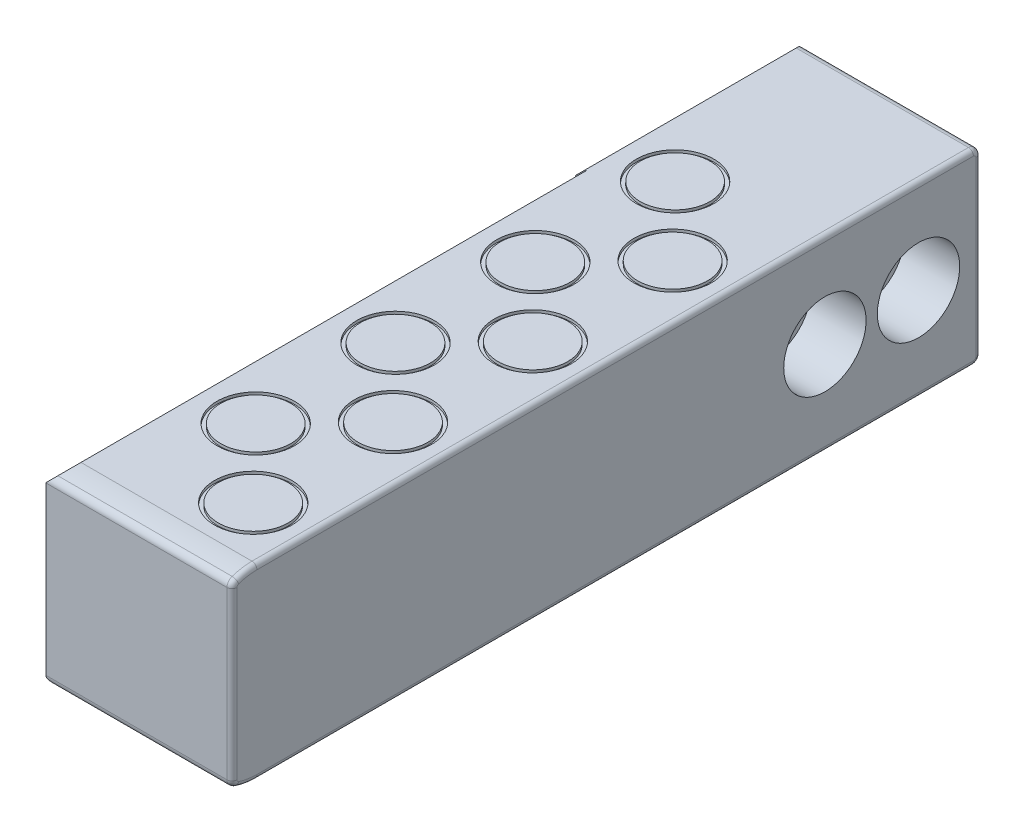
SolidWorks part; units mm, degrees
ref_plane "Front Plane" through (0, 0, 0) normal (0, 0, 1) x (1, 0, 0)
ref_plane "Top Plane" through (0, 0, 0) normal (0, 1, 0) x (1, 0, 0)
ref_plane "Right Plane" through (0, 0, 0) normal (1, 0, 0) x (0, 0, -1)
sketch "Sketch1" plane through (0, 0, 0) normal (1, 0, 0) x (0, 0, -1)
  line L0 (0, 0) -> (-53.975, 0) construction
  line L1 (-51.435, -9.525) -> (21.463, -9.525)
  line L2 (-53.975, -8.4726) -> (-53.975, 8.4726)
  line L3 (-51.435, 9.525) -> (21.463, 9.525)
  line L4 (22.225, -8.763) -> (22.225, 8.763)
  line L5 (0, 0) -> (22.225, 0) construction
  arc A0 (21.463, -9.525) -> (22.225, -8.763) centre (21.463, -8.763) ccw
  arc A1 (21.463, 9.525) -> (22.225, 8.763) centre (21.463, 8.763) cw
  arc A2 (-51.435, 9.525) -> (-53.4555, 9.195) centre (-51.435, 3.175) ccw
  arc A3 (-51.435, -9.525) -> (-53.4555, -9.195) centre (-51.435, -3.175) cw
  arc A4 (-53.975, -8.4726) -> (-53.4555, -9.195) centre (-53.213, -8.4726) ccw
  arc A5 (-53.4555, 9.195) -> (-53.975, 8.4726) centre (-53.213, 8.4726) ccw
  circle A6 centre (15.875, 0) radius 2.794
  circle A7 centre (6.35, 0) radius 2.794
  point P17 (-53.975, -8.9949)
  point P20 (-53.975, 8.9949)
  dimension "D5" = 0.762
  dimension "D9" = 6.35
  dimension "D4" = 0.762
  dimension "D7" = 5.588
  dimension "D10" = 5.588
  dimension "D2" = 76.2
  dimension "D3" = 22.225
  dimension "D6" = 2.54
  dimension "D8" = 6.35
  dimension "D11" = 9.525
  dimension "D12" = 19.05
extrude "Boss-Extrude1" add sketch "Sketch1" against normal blind 19.05
sketch "Sketch2" plane through (0, 9.525, 0) normal (0, 1, 0) x (1, 0, 0)
  line L0 (-19.05, 21.463) -> (-19.05, -51.435) construction
  line L1 (0, 21.463) -> (0, -51.435) construction
  line L5 (-19.05, -51.435) -> (0, -51.435) construction
  circle A2 centre (-12.446, -39.116) radius 3.937
  circle A3 centre (-12.446, -39.116) radius 3.556
  circle A4 centre (-5.588, -46.228) radius 3.556
  circle A5 centre (-5.588, -46.228) radius 3.937
  dimension "D1" = 1.27
  dimension "D2" = 5.588
  dimension "D5" = 7.874
  dimension "D7" = 6.604
  dimension "D8" = 7.112
  dimension "D3" = 7.112
  dimension "D4" = 6.858
  dimension "D9" = 12.446
extrude "Cut-Extrude1" cut sketch "Sketch2" against normal blind 0.2794
pattern_linear "LPattern2" count 4 spacing 14.224 along (0, 0, -1) of "Cut-Extrude1"
sketch "Sketch7" plane through (0, -9.525, 0) normal (0, -1, 0) x (1, 0, 0)
  line L0 (0, 79.1858) -> (0, -3.3956) construction
  line L2 (5.5876, 0) -> (-33.2441, 0) construction
  circle A0 centre (-4.572, 66.04) radius 3.556
  circle A1 centre (-4.572, 66.04) radius 3.175
  circle A2 centre (-13.716, 66.04) radius 3.556
  circle A3 centre (-13.716, 66.04) radius 3.175
  circle A4 centre (-9.144, 59.436) radius 3.556
  circle A5 centre (-9.144, 59.436) radius 3.175
  dimension "D1" = 66.04
  dimension "D2" = 0.381
  dimension "D7" = 7.112
  dimension "D3" = 4.572
  dimension "D4" = 9.144
  dimension "D5" = 4.572
  dimension "D6" = 6.604
extrude "Cut-Extrude4" [suppressed] cut sketch "Sketch7" against normal blind 0.2794
pattern_linear "LPattern4" [suppressed] count 4 spacing 13.208
mirror "Mirror1" about plane through (0, 0, 0) normal (0, 1, 0) of "LPattern2", "Cut-Extrude1"
fillet "Fillet3" radius 0.508 12 edges at (0, 0, 53.975) (0, 8.9175, 53.8316) (0, 9.442, 52.4586) (0, 9.525, 14.986) (0, 9.3018, -22.0018) (0, 0, -22.225) (0, -9.3018, -22.0018) (0, -9.525, 14.986) (0, -9.442, 52.4586) (0, -8.9175, 53.8316) (0, 0, -18.669) (0, 0, -9.144)
ref_plane "Plane1" through (0, 0, -44.45) normal (0, 0, 1) x (1, 0, 0)
ref_plane "Plane2" through (0, 0, -15.875) normal (0, 0, 1) x (1, 0, 0)
sketch "Sketch4" plane through (0, 0, 0) normal (0, 1, 0) x (1, 0, 0)
  line L0 (-19.05, 15.875) -> (-0.508, 15.875) construction
  line L2 (-5.588, 15.875) -> (0, 15.875)
  line L4 (-5.588, 15.875) -> (-5.588, 20.066)
  line L5 (-5.588, 20.066) -> (0, 20.066)
  line L8 (0, 15.875) -> (0, 20.066)
  line L9 (0, 21.463) -> (0, -51.435) construction
  dimension "D1" = 4.191
  dimension "D2" = 5.588
revolve "Cut-Revolve1" cut sketch "Sketch4" angle 360 about axis through (-19.05, 0, -15.875) along (1, 0, 0)
pattern_linear "LPattern3" count 2 spacing 9.525 along (0, 0, 1) of "Cut-Revolve1"
sketch "Sketch5" plane through (-19.05, 0, 0) normal (-1, 0, 0) x (0, 0, 1)
  line L1 (0, -19.05) -> (127, -19.05)
  line L2 (0, -19.05) -> (0, 19.05)
  line L3 (0, 19.05) -> (127, 19.05)
  line L4 (127, -19.05) -> (127, 19.05)
  line L5 (10.4775, 0) -> (-10.4775, 0) construction
  dimension "D1" = 19.05
  dimension "D2" = 19.05
  dimension "D3" = 127
extrude "Cut-Extrude2" cut sketch "Sketch5" against normal blind 0.127
chamfer "Chamfer1" distance 1.016 angle 45 1 edges at (-18.923, 9.525, 25.7175)
chamfer "Chamfer2" distance 1.016 angle 45 3 edges at (-19.05, -9.525, -10.7315) (-19.05, 0, -22.225) (-19.05, 9.525, -10.7315)
other "DeleteFace1" [suppressed]
sketch "Sketch6" plane through (0, 0, 0) normal (1, 0, 0) x (0, 0, -1)
  line L0 (6.35, 4.191) -> (15.875, 4.191)
  line L1 (6.35, -4.191) -> (15.875, -4.191)
  arc A0 (6.35, 4.191) -> (6.35, -4.191) centre (6.35, 0) ccw
  arc A1 (15.875, -4.191) -> (15.875, 4.191) centre (15.875, 0) ccw
  circle A2 centre (15.875, 0) radius 4.191 construction
  circle A3 centre (6.35, 0) radius 4.191 construction
extrude "Cut-Extrude3" [suppressed] cut sketch "Sketch6" against normal up to surface (5.588 mm away)
chamfer "Chamfer3" [suppressed] distance 0.508 angle 45
